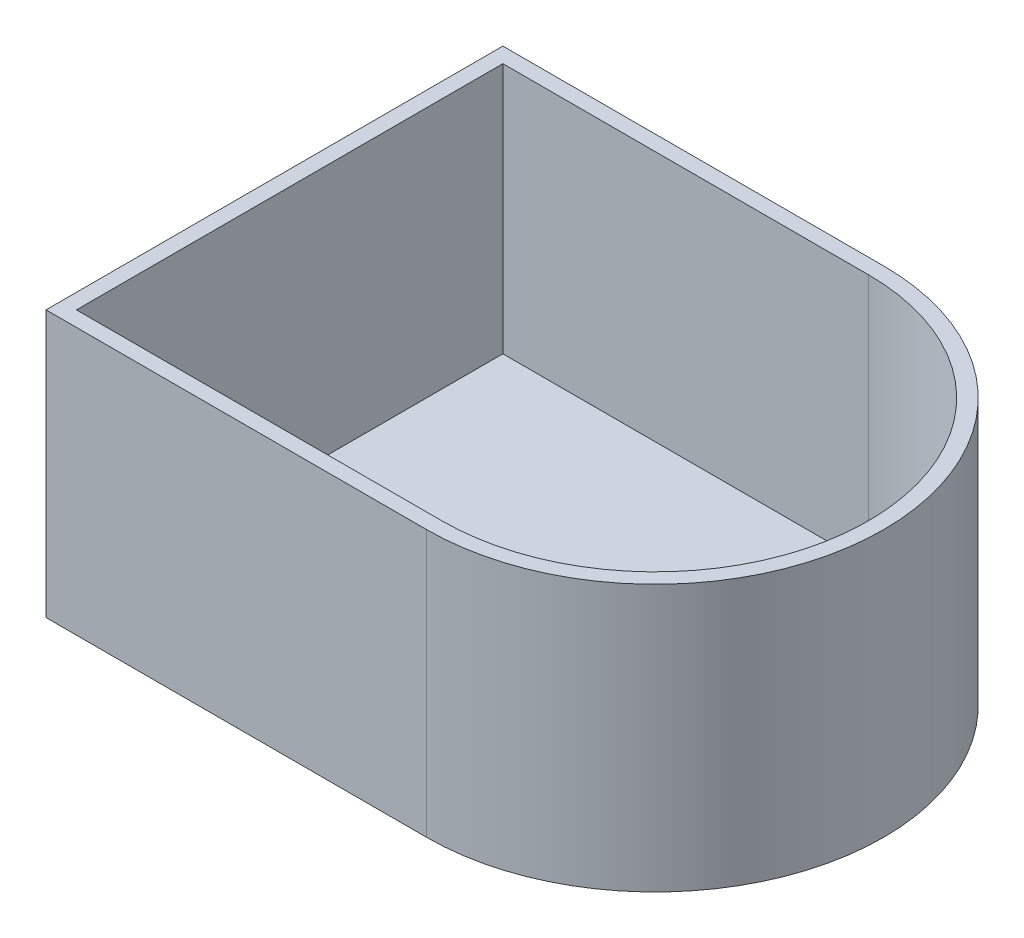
SolidWorks part; units mm, degrees
ref_plane "Front Plane" through (0, 0, 0) normal (0, 0, 1) x (1, 0, 0)
ref_plane "Top Plane" through (0, 0, 0) normal (0, 1, 0) x (1, 0, 0)
ref_plane "Right Plane" through (0, 0, 0) normal (1, 0, 0) x (0, 0, -1)
sketch "Sketch1" plane through (0, 0, 0) normal (0, 1, 0) x (1, 0, 0)
  line L0 (-25, 30) -> (25, -30) construction
  line L1 (-25, -30) -> (25, -30)
  line L2 (-25, -30) -> (-25, 30)
  line L3 (-25, 30) -> (25, 30)
  arc A0 (25, -30) -> (25, 30) centre (25, 0) ccw
  dimension "D2" = 30
  dimension "D1" = 50
extrude "Extrude1" add sketch "Sketch1" along normal blind 35
shell "Shell1" thickness 2
ref_plane "Plane1" through (70, 0, 0) normal (1, 0, 0) x (0, 0, -1)
sketch "Sketch2" plane through (70, 0, 0) normal (1, 0, 0) x (0, 0, -1)
  line L0 (-12.364, 24.864) -> (-12.364, 10.136)
  line L1 (-6, 7.5) -> (6, 7.5)
  line L2 (-15, 16.5) -> (-15, 18.5)
  line L3 (-6, 27.5) -> (6, 27.5)
  line L4 (15, 16.5) -> (15, 18.5)
  line L5 (-6, 27.5) -> (-6, 7.5)
  line L6 (0, 27.5) -> (0, 7.5)
  line L7 (6, 27.5) -> (6, 7.5)
  line L8 (12.364, 24.864) -> (12.364, 10.136)
  line L9 (-14.3684, 21.8121) -> (14.3684, 21.8121)
  line L10 (-15, 17.5) -> (15, 17.5)
  line L11 (-14.3684, 13.1879) -> (14.3684, 13.1879)
  arc A0 (-15, 18.5) -> (-6, 27.5) centre (-6, 18.5) cw
  arc A1 (-6, 7.5) -> (-15, 16.5) centre (-6, 16.5) cw
  arc A2 (6, 7.5) -> (15, 16.5) centre (6, 16.5) ccw
  arc A3 (6, 27.5) -> (15, 18.5) centre (6, 18.5) cw
  point P7 (-15, 27.5)
  point P10 (-15, 7.5)
  point P15 (15, 27.5)
  dimension "D6" = 9
  dimension "D1" = 30
  dimension "D2" = 20
  dimension "D3" = 15
  dimension "D4" = 7.5
